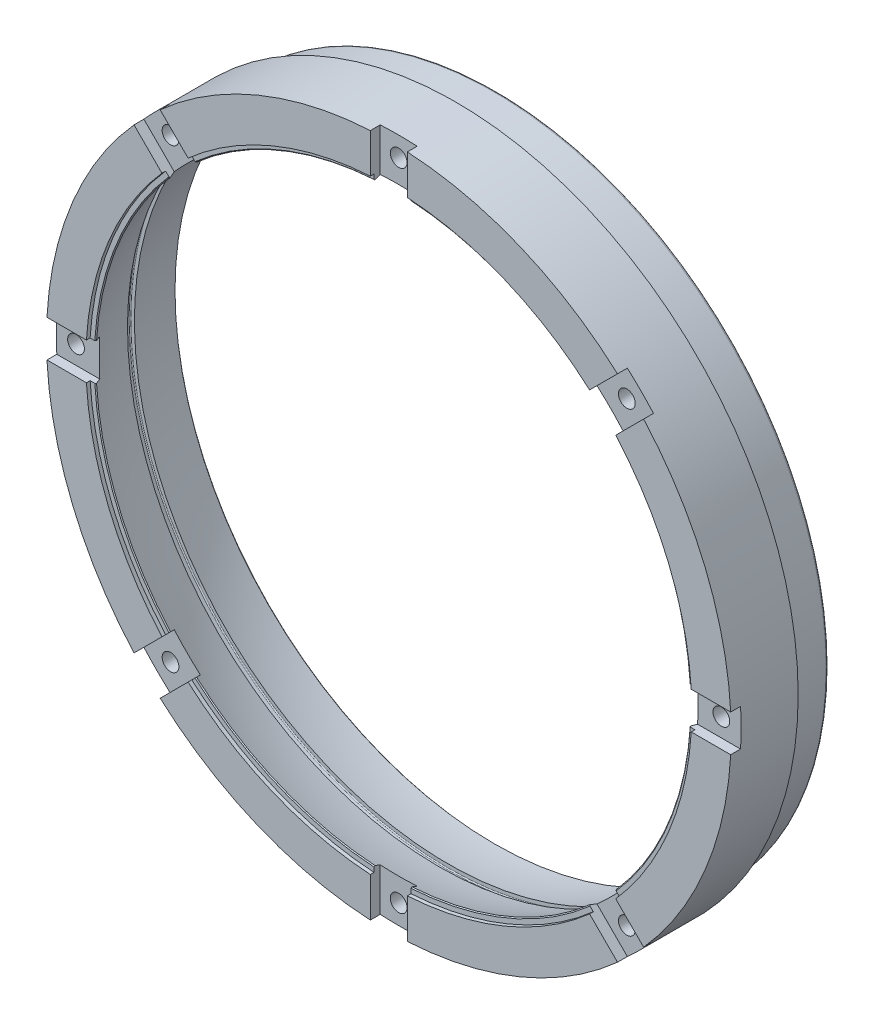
SolidWorks part; units mm, degrees
ref_plane "Plan de face" through (0, 0, 0) normal (0, 0, 1) x (1, 0, 0)
ref_plane "Plan de dessus" through (0, 0, 0) normal (0, 1, 0) x (1, 0, 0)
ref_plane "Plan de droite" through (0, 0, 0) normal (1, 0, 0) x (0, 0, -1)
sketch "Esquisse1" plane through (0, 0, 0) normal (1, 0, 0) x (0, 0, -1)
  line L0 (0, 0) -> (60.8253, 0) construction
  line L1 (0, 123) -> (0, 139)
  line L2 (0, 139) -> (27.1906, 139)
  line L3 (27.1906, 139) -> (29.5, 135)
  line L4 (29.5, 135) -> (43.5, 135)
  line L5 (43.5, 135) -> (43.5, 129.8374)
  line L6 (1.5, 120.6141) -> (1.5, 123)
  line L7 (1.5, 123) -> (0, 123)
  line L8 (20.5, 126.6086) -> (20.5, 129.18)
  line L9 (20.5, 129.18) -> (24.1, 129.18)
  line L10 (24.1, 129.18) -> (24.1, 127.3938)
  arc A0 (43.5, 129.8374) -> (24.1, 127.3938) centre (50, 0) ccw
  arc A1 (20.5, 126.6086) -> (1.5, 120.6141) centre (50, 0) ccw
  dimension "D3" = 130
  dimension "D1" = 278
  dimension "D2" = 246
  dimension "D4" = 50
  dimension "D5" = 43.5
  dimension "D6" = 1.5
  dimension "D7" = 30
  dimension "D8" = 270
  dimension "D9" = 29.5
  dimension "D10" = 258.36
  dimension "D11" = 19.4
  dimension "D12" = 3.6
revolve "Révolution1" add sketch "Esquisse1" angle 360 about L0
chamfer "Chanfrein1" distance 0.5 angle 45 1 edges at (120.6141, 0, -1.5)
sketch "Esquisse2" plane through (0, 0, 0) normal (0, 0, 1) x (1, 0, 0)
  line L0 (0, 151.6523) -> (0, -154.7552) construction
  line L1 (7.5, 146.6102) -> (-7.5, 146.6102)
  line L2 (-7.5, 146.6102) -> (-7.5, 107.4365)
  line L3 (-7.5, 107.4365) -> (7.5, 107.4365)
  line L4 (7.5, 146.6102) -> (7.5, 107.4365)
  point P8 (0, 146.6102)
  point P9 (0, 107.4365)
  dimension "D1" = 15
extrude "Extrusion1" cut sketch "Esquisse2" against normal blind 4
pattern_circular "Répétition circulaire1" count 8 over 360 about axis through (0, 0, 0) along (0, 0, 1) of "Extrusion1"
sketch "Esquisse3" plane through (0, 0, 0) normal (0, 0, 1) x (1, 0, 0)
  circle A0 centre (0, 0) radius 131 construction
  dimension "D1" = 262
hole_wizard "Trou taraudé M81" positions "Esquisse5" profile "Esquisse4" tap size "M8" standard "ISO"
sketch "Esquisse5" plane through (0, 0, -4) normal (0, 0, 1) x (1, 0, 0)
  circle A0 centre (0, 0) radius 131 construction
  point P0 (0, 131)
sketch "Esquisse4" plane through (0, 131, -4) normal (1, 0, 0) x (0, -1, 0)
  line L0 (0, 0) -> (0, 15.0429)
  line L1 (0, 15.0429) -> (3.4, 13)
  line L2 (3.4, 13) -> (3.4, 0)
  line L5 (3.4, 0) -> (0, 0)
  line L10 (0, 15.0429) -> (-3.4, 13) construction
  line L11 (0, -6.35) -> (0, 107.95) construction
  dimension "Diamètre du trou pour taraudage" = 6.8
  dimension "Profondeur du trou pour taraudage" = 13
  dimension "Angle de pointe" = 118
pattern_circular "Répétition circulaire2" count 8 over 360 about axis through (0, 0, 0) along (0, 0, 1) of "Trou taraudé M81"
chamfer "Chanfrein2" distance 0.5 angle 45 1 edges at (129.8374, 0, -43.5)
fillet "Congé1" radius 1 1 edges at (135, 0, -43.5)
fillet "Congé2" radius 0.4 2 edges at (129.18, 0, -20.5) (129.18, 0, -24.1)
